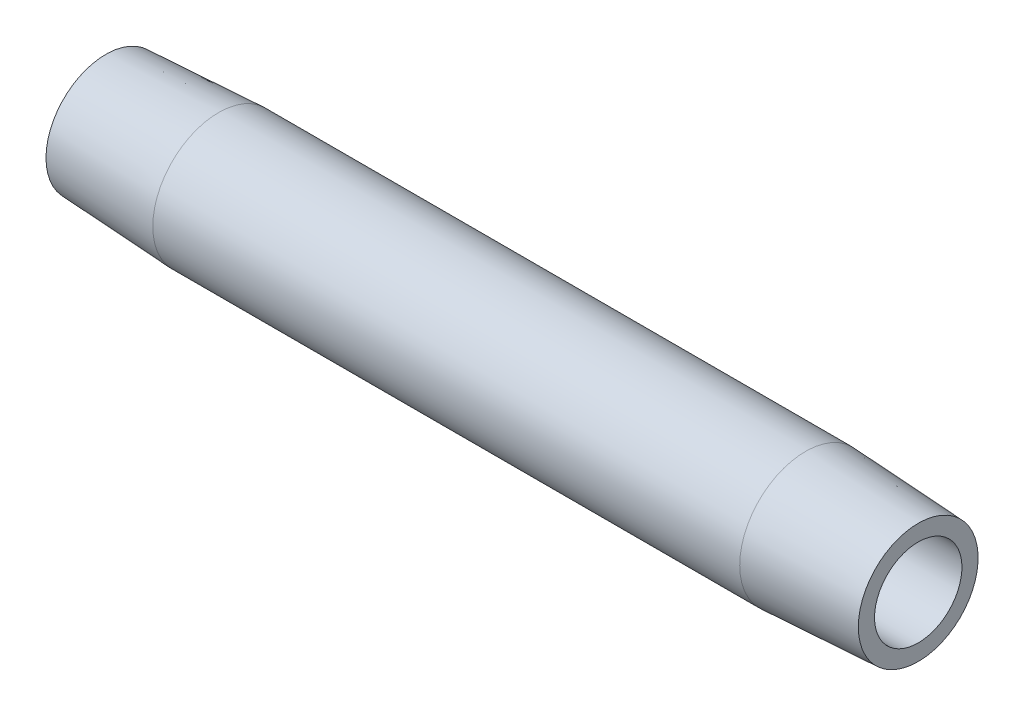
SolidWorks part; units mm, degrees
ref_plane "Front Plane" through (0, 0, 0) normal (0, 0, 1) x (1, 0, 0)
ref_plane "Top Plane" through (0, 0, 0) normal (0, 1, 0) x (1, 0, 0)
ref_plane "Right Plane" through (0, 0, 0) normal (1, 0, 0) x (0, 0, -1)
sketch "Sketch2" plane through (0, 0, 0) normal (0, 0, 1) x (1, 0, 0)
  line L0 (0.4761, 0) -> (50000.4761, 0) construction
  line L1 (0, -11.3625) -> (0, 49988.6375) construction
  line L7 (8.81, 5.1435) -> (0, 4.6818)
  line L8 (54.69, 5.1435) -> (8.81, 5.1435)
  line L9 (63.5, 4.6818) -> (54.69, 5.1435)
  line L10 (63.5, 3.4163) -> (63.5, 4.6818)
  line L11 (63.5, 3.4163) -> (0, 3.4163)
  line L12 (0, 4.6818) -> (0, 3.4163)
  dimension "D1" = 6.8326
  dimension "D2" = 10.287
  dimension "D3" = 3
  dimension "D4" = 3
  dimension "D5" = 8.81
  dimension "D6" = 8.81
  dimension "D7" = 63.5
revolve "Revolve1" add sketch "Sketch2" angle 360 about L0
